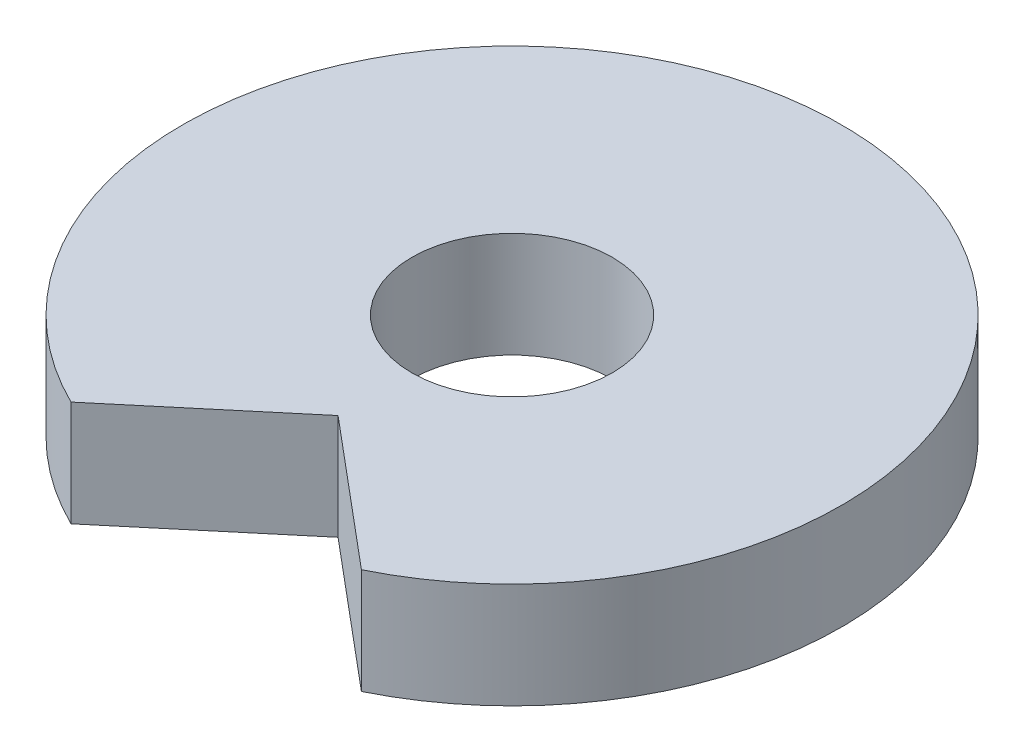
SolidWorks part; units mm, degrees
ref_plane "Front Plane" through (0, 0, 0) normal (0, 0, 1) x (1, 0, 0)
ref_plane "Top Plane" through (0, 0, 0) normal (0, 1, 0) x (1, 0, 0)
ref_plane "Right Plane" through (0, 0, 0) normal (1, 0, 0) x (0, 0, -1)
sketch "Sketch1" plane through (0, 0, 0) normal (0, 1, 0) x (1, 0, 0)
  circle A0 centre (0, 0) radius 2.413
  circle A1 centre (0, 0) radius 7.9375
  dimension "D1" = 15.875
  dimension "D2" = 4.826
extrude "Boss-Extrude1" add sketch "Sketch1" along normal blind 2.54
sketch "Sketch2" plane through (0, 2.54, 0) normal (0, 1, 0) x (1, 0, 0)
  line L0 (0, 0) -> (0, -8.9745) construction
  line L1 (0, -4.191) -> (-4.691, -8.1272)
  line L2 (0, -4.191) -> (4.691, -8.1272)
  circle A0 centre (0, 0) radius 2.413 construction
  dimension "D1" = 1.778
  dimension "D2" = 100
extrude "Cut-Extrude1" cut sketch "Sketch2" along normal through all and the other way through all flip side to cut
